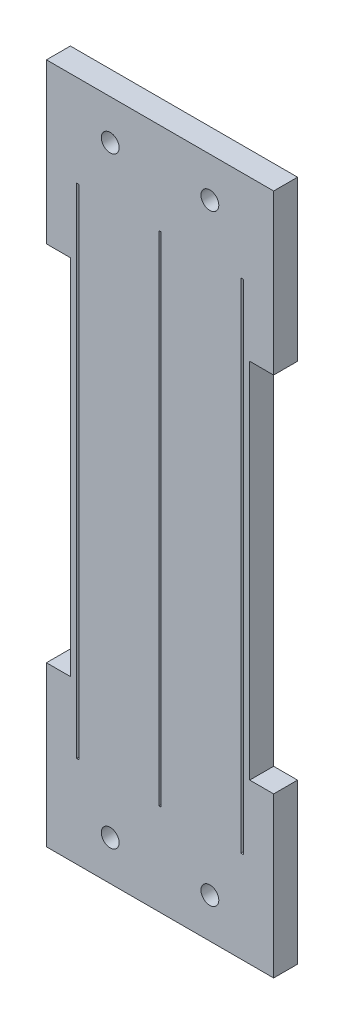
SolidWorks part; units mm, degrees
ref_plane "Plan de face" through (0, 0, 0) normal (0, 0, 1) x (1, 0, 0)
ref_plane "Plan de dessus" through (0, 0, 0) normal (0, 1, 0) x (1, 0, 0)
ref_plane "Plan de droite" through (0, 0, 0) normal (1, 0, 0) x (0, 0, -1)
sketch "Esquisse1" plane through (0, 0, 0) normal (0, 0, 1) x (1, 0, 0)
  line L1 (-22.5, 85.5) -> (22.5, 85.5)
  line L2 (-22.5, 85.5) -> (-22.5, -85.5)
  line L3 (-22.5, -85.5) -> (22.5, -85.5)
  line L4 (22.5, 85.5) -> (22.5, -85.5)
  line L5 (-22.5, 85.5) -> (22.5, -85.5) construction
  line L6 (-22.5, -85.5) -> (22.5, 85.5) construction
  point P0 (0, 0)
  dimension "D1" = 45
  dimension "D2" = 171
extrude "Boss.-Extru.1" add sketch "Esquisse1" along normal blind 6
sketch "Esquisse2" plane through (0, 0, 6) normal (0, 0, 1) x (1, 0, 0)
  line L1 (-22.5, 85.5) -> (-28.5, 85.5)
  line L2 (-22.5, 85.5) -> (-22.5, 45.5)
  line L3 (-22.5, 45.5) -> (-28.5, 45.5)
  line L4 (-28.5, 85.5) -> (-28.5, 45.5)
  dimension "D1" = 40
  dimension "D2" = 6
extrude "Boss.-Extru.2" add sketch "Esquisse2" against normal blind 6
sketch "Esquisse4" plane through (0, 0, 6) normal (0, 0, 1) x (1, 0, 0)
  line L0 (-22.5, 45.5) -> (-22.5, -85.5) construction
  line L1 (-22.5, -85.5) -> (22.5, -85.5) construction
  circle A0 centre (-12.5, -75.5) radius 2.2347
  dimension "D1" = 10
  dimension "D2" = 10
extrude "Enlèv. mat.-Extru.1" cut sketch "Esquisse4" against normal blind 6
mirror "Symétrie1" about plane through (0, 0, 0) normal (1, 0, 0) of "Enlèv. mat.-Extru.1"
mirror "Symétrie2" about plane through (0, 0, 0) normal (1, 0, 0) of "Boss.-Extru.2"
mirror "Symétrie3" about plane through (0, 0, 0) normal (0, 1, 0) of "Symétrie2", "Boss.-Extru.2"
mirror "Symétrie4" about plane through (0, 0, 0) normal (0, 1, 0) of "Enlèv. mat.-Extru.1"
mirror "Symétrie5" about plane through (0, 0, 0) normal (1, 0, 0) of "Symétrie4"
sketch "Esquisse5" plane through (0, 0, 6) normal (0, 0, 1) x (1, 0, 0)
  line L1 (-0.3, -62.5) -> (0.3, -62.5)
  line L2 (-0.3, -62.5) -> (-0.3, 62.5)
  line L3 (-0.3, 62.5) -> (0.3, 62.5)
  line L4 (0.3, -62.5) -> (0.3, 62.5)
  line L5 (-0.3, -62.5) -> (0.3, 62.5) construction
  line L6 (-0.3, 62.5) -> (0.3, -62.5) construction
  line L7 (-20.9, 62.5) -> (-20.3, 62.5)
  line L8 (-20.9, 62.5) -> (-20.9, -62.5)
  line L9 (-20.9, -62.5) -> (-20.3, -62.5)
  line L10 (-20.3, 62.5) -> (-20.3, -62.5)
  line L11 (-20.9, 62.5) -> (-20.3, -62.5) construction
  line L12 (-20.9, -62.5) -> (-20.3, 62.5) construction
  point P0 (0, 0)
  point P5 (-20.6, 0)
  dimension "D1" = 0.6
  dimension "D2" = 125
  dimension "D3" = 20
extrude "Enlèv. mat.-Extru.2" cut sketch "Esquisse5" against normal blind 10
mirror "Symétrie6" about plane through (0, 0, 0) normal (1, 0, 0) of "Enlèv. mat.-Extru.2"
